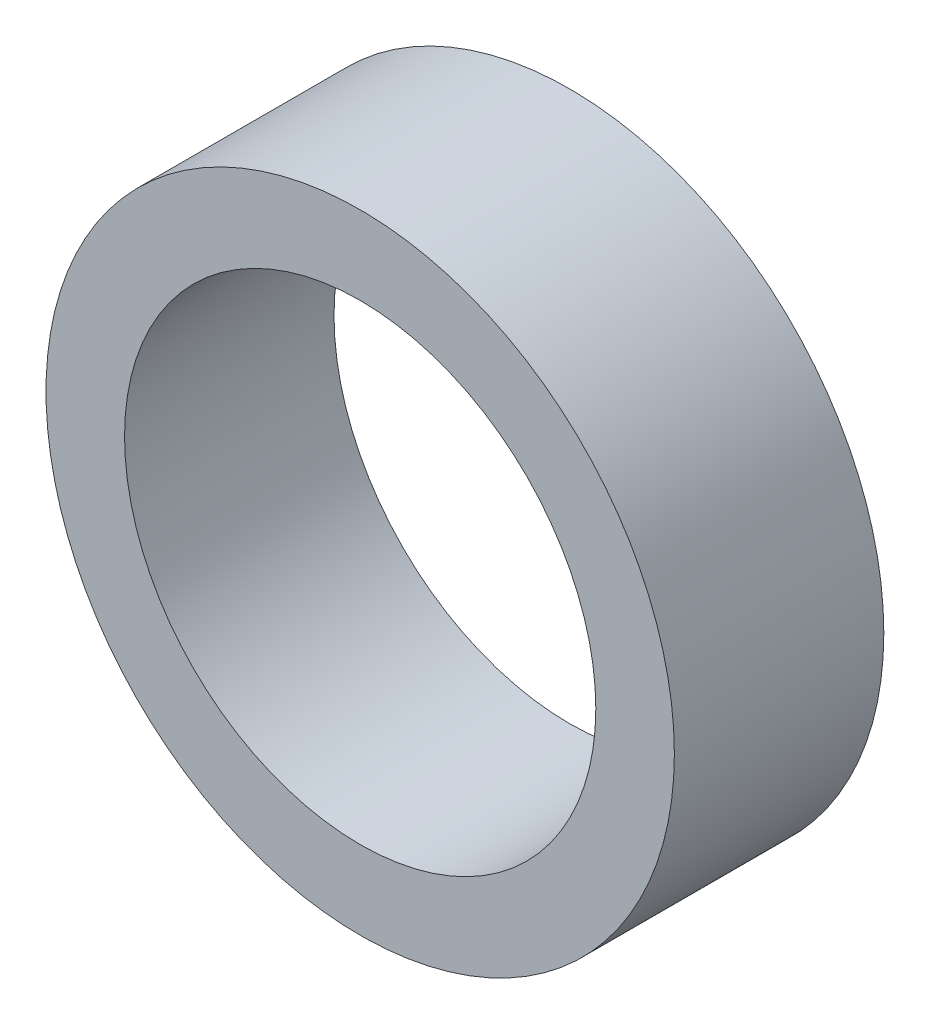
SolidWorks part; units mm, degrees
ref_plane "Face" through (0, 0, 0) normal (0, 0, 1) x (1, 0, 0)
ref_plane "Dessus" through (0, 0, 0) normal (0, 1, 0) x (1, 0, 0)
ref_plane "Droite" through (0, 0, 0) normal (1, 0, 0) x (0, 0, -1)
sketch "Esquisse1" plane through (0, 0, 0) normal (0, 0, 1) x (1, 0, 0)
  circle A0 centre (0, 0) radius 9
  circle A1 centre (0, 0) radius 12
  dimension "D1" = 18
  dimension "D2" = 3
extrude "Extrusion1" add sketch "Esquisse1" along normal blind 8
